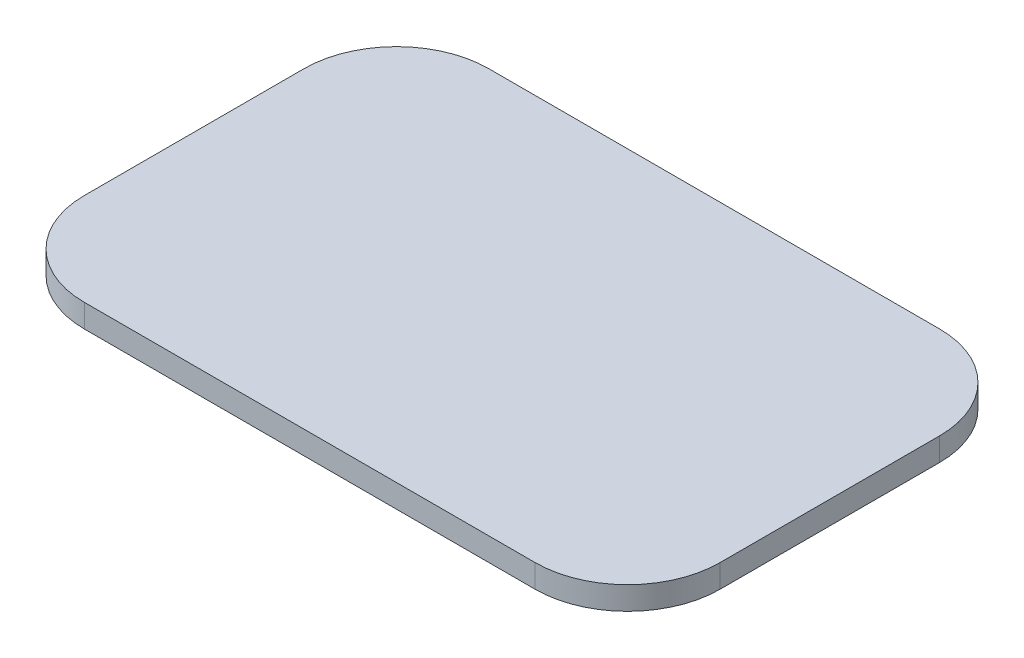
SolidWorks part; units mm, degrees
ref_plane "Front Plane" through (0, 0, 0) normal (0, 0, 1) x (1, 0, 0)
ref_plane "Top Plane" through (0, 0, 0) normal (0, 1, 0) x (1, 0, 0)
ref_plane "Right Plane" through (0, 0, 0) normal (1, 0, 0) x (0, 0, -1)
sketch "Sketch1" plane through (0, 0, 0) normal (0, 1, 0) x (1, 0, 0)
  line L1 (-19.5, -17.5) -> (19.5, -17.5)
  line L2 (-27.5, -9.5) -> (-27.5, 9.5)
  line L3 (-19.5, 17.5) -> (19.5, 17.5)
  line L4 (27.5, -9.5) -> (27.5, 9.5)
  line L5 (-27.5, -17.5) -> (27.5, 17.5) construction
  line L6 (-27.5, 17.5) -> (27.5, -17.5) construction
  arc A0 (19.5, -17.5) -> (27.5, -9.5) centre (19.5, -9.5) ccw
  arc A1 (19.5, 17.5) -> (27.5, 9.5) centre (19.5, 9.5) cw
  arc A2 (-27.5, 9.5) -> (-19.5, 17.5) centre (-19.5, 9.5) cw
  arc A3 (-19.5, -17.5) -> (-27.5, -9.5) centre (-19.5, -9.5) cw
  point P0 (0, 0)
  dimension "D3" = 8
  dimension "D1" = 35
  dimension "D2" = 55
extrude "Boss-Extrude1" add sketch "Sketch1" along normal blind 2
